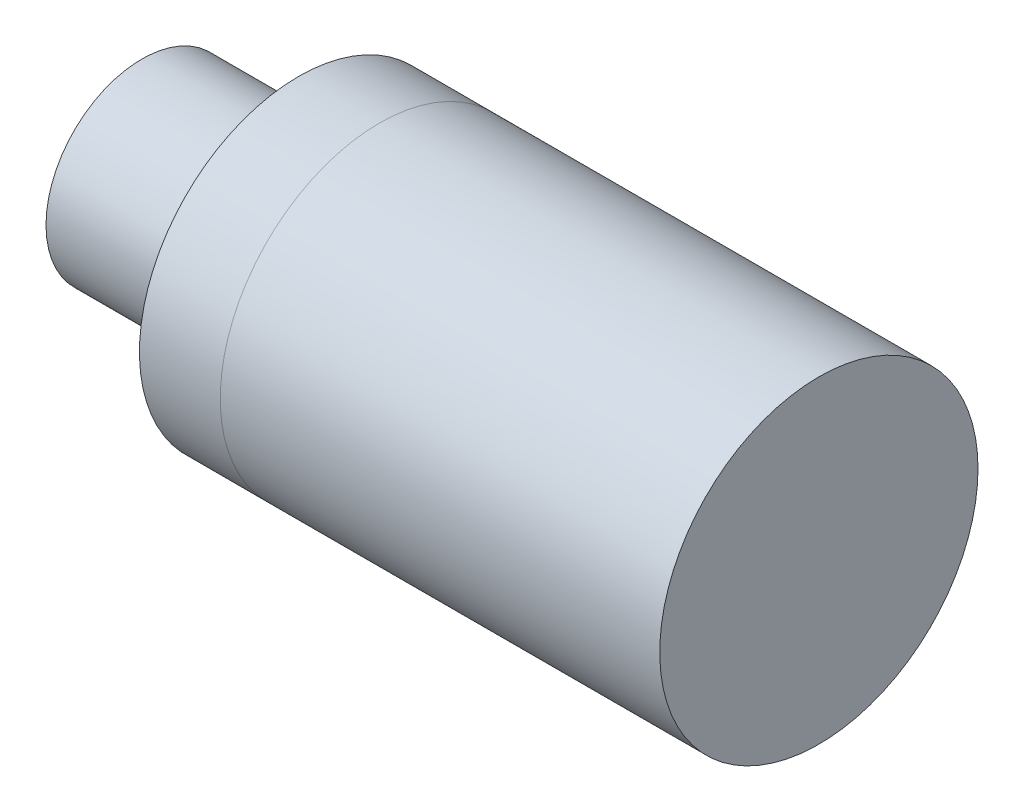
SolidWorks part; units mm, degrees
ref_plane "Front" through (0, 0, 0) normal (0, 0, 1) x (1, 0, 0)
ref_plane "Top" through (0, 0, 0) normal (0, 1, 0) x (1, 0, 0)
ref_plane "Right" through (0, 0, 0) normal (1, 0, 0) x (0, 0, -1)
sketch "Sketch1" plane through (0, 0, 0) normal (1, 0, 0) x (0, 0, -1)
  circle A0 centre (0, 0) radius 2.413
  dimension "D1" = 4.826
extrude "Extrude1" add sketch "Sketch1" along normal blind 3.937
sketch "Sketch2" plane through (3.937, 0, 0) normal (1, 0, 0) x (0, 0, -1)
  circle A0 centre (0, 0) radius 4.0005
  dimension "D1" = 8.001
extrude "Extrude2" add sketch "Sketch2" along normal blind 13.081
sketch "Sketch4" plane through (0, 0, 0) normal (0, 0, 1) x (1, 0, 0)
  line L0 (5.969, 6.5609) -> (5.969, -6.7009)
  line L1 (3.937, 4.0005) -> (3.937, -4.0005) construction
  dimension "D1" = 2.032
